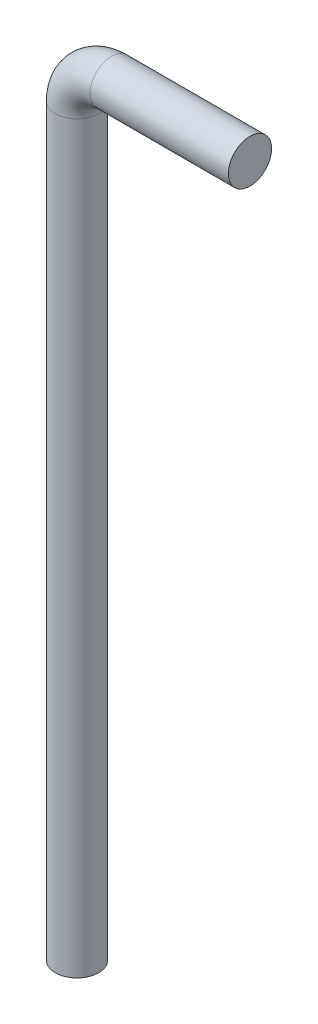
SolidWorks part; units mm, degrees
ref_plane "正面" through (0, 0, 0) normal (0, 0, 1) x (1, 0, 0)
ref_plane "平面" through (0, 0, 0) normal (0, 1, 0) x (1, 0, 0)
ref_plane "右側面" through (0, 0, 0) normal (1, 0, 0) x (0, 0, -1)
sketch "ｽｹｯﾁ1" plane through (0, 0, 0) normal (0, 0, 1) x (1, 0, 0)
  line L0 (-8, 0) -> (0, 0)
  line L1 (-10, -2) -> (-10, -45)
  arc A0 (-10, -2) -> (-8, 0) centre (-8, -2) cw
  point P5 (-10, 0)
  dimension "D3" = 2
  dimension "D1" = 45
  dimension "D2" = 10
sketch "ｽｹｯﾁ2" plane through (0, 0, 0) normal (1, 0, 0) x (0, 0, -1)
  circle A0 centre (0, 0) radius 1.25
  dimension "D1" = 2.5
sweep "ｽｲｰﾌﾟ1" add profiles "ｽｹｯﾁ2" path "ｽｹｯﾁ1"
